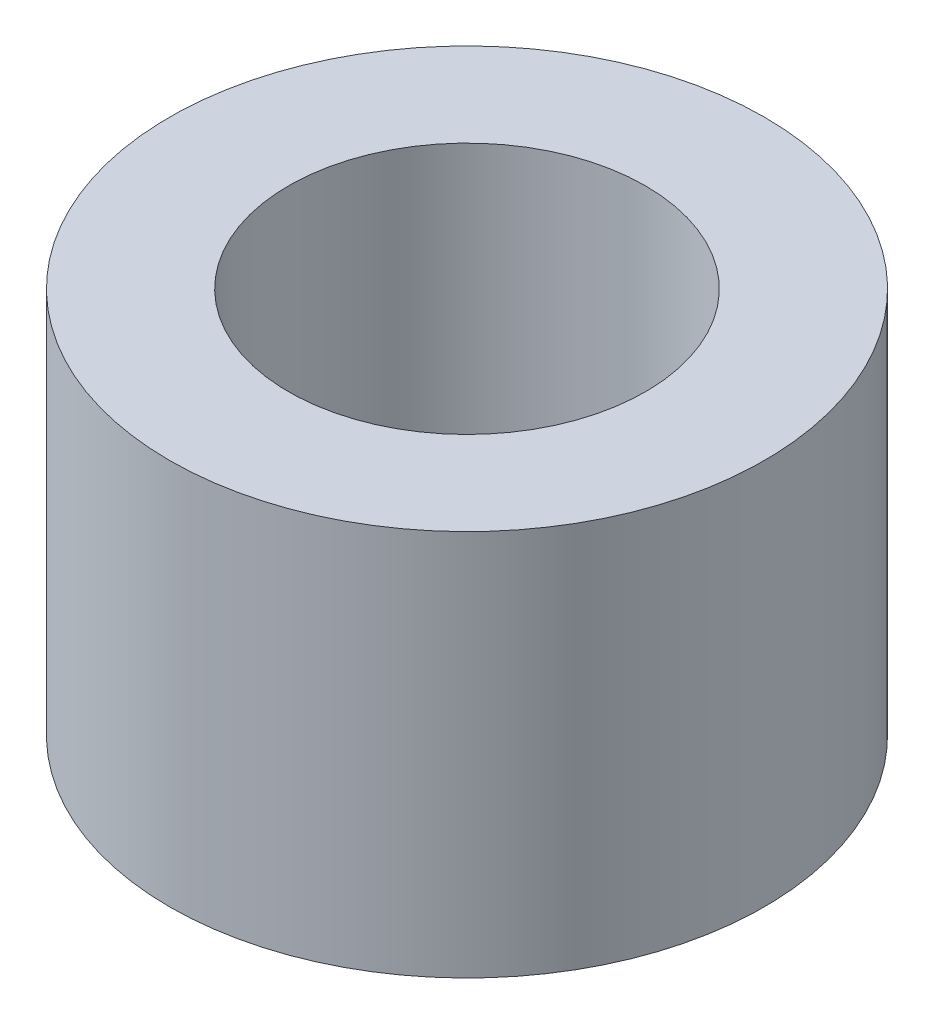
SolidWorks part; units mm, degrees
ref_plane "Front" through (0, 0, 0) normal (0, 0, 1) x (1, 0, 0)
ref_plane "Top" through (0, 0, 0) normal (0, 1, 0) x (1, 0, 0)
ref_plane "Right" through (0, 0, 0) normal (1, 0, 0) x (0, 0, -1)
sketch "Sketch1" plane through (0, 0, 0) normal (0, 1, 0) x (1, 0, 0)
  circle A0 centre (0, 0) radius 3
  circle A1 centre (0, 0) radius 5
extrude "Extrude1" add sketch "Sketch1" along normal blind 6.5
